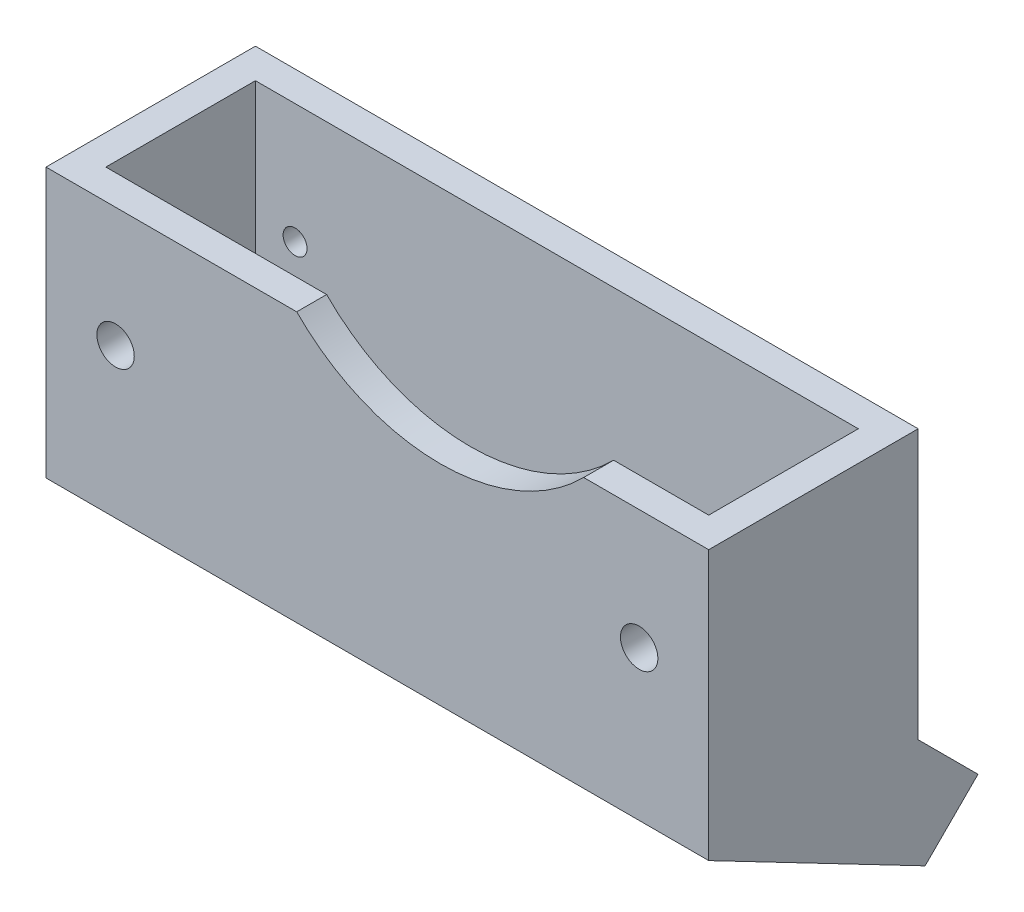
SolidWorks part; units mm, degrees
ref_plane "Aufriss" through (0, 0, 0) normal (0, 0, 1) x (1, 0, 0)
ref_plane "Grundriss" through (0, 0, 0) normal (0, 1, 0) x (1, 0, 0)
ref_plane "Seitenriss" through (0, 0, 0) normal (1, 0, 0) x (0, 0, -1)
sketch "Skizze1" plane through (0, 0, 0) normal (0, 1, 0) x (1, 0, 0)
  line L1 (-20.15, -5) -> (20.15, -5)
  line L2 (-20.15, -5) -> (-20.15, 5)
  line L3 (-20.15, 5) -> (20.15, 5)
  line L4 (20.15, -5) -> (20.15, 5)
  line L5 (-20.15, -5) -> (20.15, 5) construction
  line L6 (-20.15, 5) -> (20.15, -5) construction
  line L7 (-22.15, -7) -> (22.15, -7)
  line L8 (-22.15, -7) -> (-22.15, 7)
  line L9 (-22.15, 7) -> (22.15, 7)
  line L10 (22.15, -7) -> (22.15, 7)
  line L11 (-22.15, -7) -> (22.15, 7) construction
  line L12 (-22.15, 7) -> (22.15, -7) construction
  point P0 (0, 0)
  point P6 (0, 0)
  dimension "D1" = 10
  dimension "D2" = 40.3
  dimension "D3" = 2
  dimension "D4" = 2
extrude "Aufsatz-Linear austragen1" add sketch "Skizze1" against normal blind 18
hole_wizard "Ø2.5 (2.5) Durchmesser Bohrung1" positions "Skizze2" profile "Skizze3" hole size "Ø2.5" standard "DIN"
sketch "Skizze2" plane through (0, 0, 7) normal (0, 0, 1) x (1, 0, 0)
  line L0 (-22.15, 0) -> (22.15, 0) construction
  point P0 (-17.5, -8)
  point P2 (17.5, -8)
  dimension "D1" = 17.5
  dimension "D2" = 17.5
  dimension "D3" = 8
sketch "Skizze3" plane through (-17.5, -8, 7) normal (1, 0, 0) x (0, -1, 0)
  line L0 (0, 0) -> (0, 2)
  line L1 (0, 2) -> (1.25, 2)
  line L2 (1.25, 2) -> (1.25, 0)
  line L5 (1.25, 0) -> (0, 0)
  line L11 (0, -6.35) -> (0, 107.95) construction
  dimension "Bohrerdurchmesser" = 2.5
  dimension "Bohrungstiefe" = 2
hole_wizard "M2 Gewindebohrung1" positions "Skizze4" profile "Skizze5" tap size "M2" standard "DIN"
sketch "Skizze4" plane through (0, 0, -5) normal (0, 0, 1) x (1, 0, 0)
  point P0 (-17.5, -8)
  point P3 (17.5, -8)
sketch "Skizze5" plane through (-17.5, -8, -5) normal (1, 0, 0) x (0, -1, 0)
  line L0 (0, 0) -> (0, 2)
  line L1 (0, 2) -> (0.8, 2)
  line L2 (0.8, 2) -> (0.8, 0)
  line L5 (0.8, 0) -> (0, 0)
  line L11 (0, -6.35) -> (0, 107.95) construction
  dimension "Bohrerdurchmesser" = 1.6
  dimension "Bohrungstiefe" = 2
sketch "Skizze7" plane through (-22.15, 0, 0) normal (-1, 0, 0) x (0, 0, 1)
  line L0 (-7, -18) -> (-11, -22)
  line L1 (-11, -22) -> (-7.4645, -25.5355)
  line L2 (-7.4645, -25.5355) -> (7, -18)
  line L3 (7, -18) -> (-7, -18)
  line L4 (-7, -18) -> (-7, 0) construction
  dimension "D1" = 135
  dimension "D2" = 5
  dimension "D3" = 4
extrude "Aufsatz-Linear austragen2" add sketch "Skizze7" against normal up to surface (44.3 mm away)
sketch "Skizze8" plane through (20.15, 0, 0) normal (-1, 0, 0) x (0, 0, 1)
  line L0 (-5, -18) -> (5, -18)
  line L1 (5, -18) -> (-8.1495, -24.8505)
  line L2 (-11, -22) -> (-7.4645, -25.5355) construction
  line L3 (-8.1495, -24.8505) -> (-10, -23)
  line L4 (-10, -23) -> (-5, -18)
  line L5 (-7, -18) -> (-11, -22) construction
  line L6 (-7.4645, -25.5355) -> (7, -18) construction
extrude "Schnitt-Linear austragen1" cut sketch "Skizze8" along normal up to surface (40.3 mm away)
sketch "Skizze9" plane through (0, 0, 7) normal (0, 0, 1) x (1, 0, 0)
  line L0 (-22.15, 0) -> (22.15, 0) construction
  line L1 (-22.15, -18) -> (-22.15, 0) construction
  circle A0 centre (4.2, 9.5) radius 13.5
  dimension "D3" = 27
  dimension "D1" = 9.5
  dimension "D2" = 26.35
extrude "Schnitt-Linear austragen2" cut sketch "Skizze9" against normal up to next
sketch "Skizze10" plane through (0, -16.2063, 8.443) normal (0, 0.8869, -0.462) x (1, 0, 0)
  line L0 (8.15, 18.7092) -> (20.15, 18.7092)
  line L1 (-20.15, 18.7092) -> (20.15, 18.7092) construction
  line L2 (20.15, 18.7092) -> (20.15, 12.7092)
  line L3 (20.15, 12.7092) -> (8.15, 18.7092)
  line L4 (-8.15, 18.7092) -> (-20.15, 18.7092)
  line L5 (-20.15, 18.7092) -> (-20.15, 3.8822) construction
  line L6 (-20.15, 18.7092) -> (-20.15, 12.7092)
  line L7 (-20.15, 12.7092) -> (-8.15, 18.7092)
  dimension "D1" = 12
  dimension "D2" = 6
extrude "Aufsatz-Linear austragen3" add sketch "Skizze10" along normal up to surface (4.6334 mm away)
sketch "Skizze11" plane through (0, -8.6442, -16.5925) normal (0, -0.462, -0.8869) x (-1, 0, 0)
  line L4 (-8.15, -18.2737) -> (-8.15, -15.53)
  line L5 (-8.15, -15.53) -> (-20.15, -15.53)
  line L6 (-20.15, -15.53) -> (-20.15, -18.2737)
  line L7 (-20.15, -18.2737) -> (-8.15, -18.2737)
  line L8 (-8.15, -18.2737) -> (-8.15, -15.53)
  line L9 (-8.15, -15.53) -> (-20.15, -15.53)
  line L10 (-20.15, -15.53) -> (-20.15, -18.2737)
  line L11 (-20.15, -18.2737) -> (-8.15, -18.2737)
  line L12 (20.15, -18.2737) -> (20.15, -15.53)
  line L13 (20.15, -15.53) -> (8.15, -15.53)
  line L14 (8.15, -15.53) -> (8.15, -18.2737)
  line L15 (8.15, -18.2737) -> (20.15, -18.2737)
  line L16 (20.15, -18.2737) -> (20.15, -15.53)
  line L17 (20.15, -15.53) -> (8.15, -15.53)
  line L18 (8.15, -15.53) -> (8.15, -18.2737)
  line L19 (8.15, -18.2737) -> (20.15, -18.2737)
  dimension "D1" = 0
  dimension "D2" = 0
extrude "Aufsatz-Linear austragen4" add sketch "Skizze11" along normal up to surface (0.8641 mm away)
